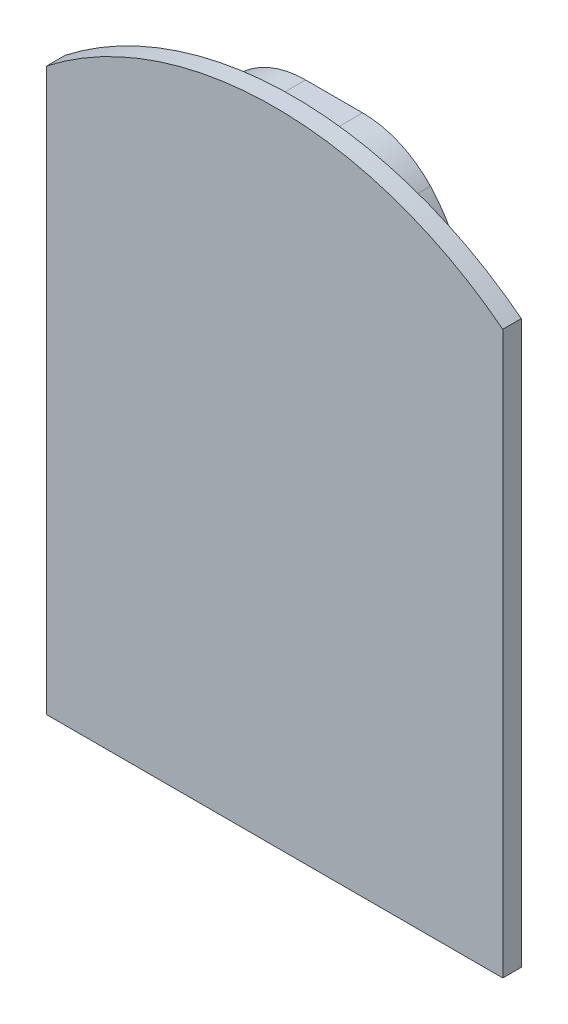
SolidWorks part; units mm, degrees
ref_plane "Front Plane" through (0, 0, 0) normal (0, 0, 1) x (1, 0, 0)
ref_plane "Top Plane" through (0, 0, 0) normal (0, 1, 0) x (1, 0, 0)
ref_plane "Right Plane" through (0, 0, 0) normal (1, 0, 0) x (0, 0, -1)
sketch "Sketch1" plane through (0, 0, 0) normal (0, 0, 1) x (1, 0, 0)
  line L0 (0, 0) -> (0, -30.3)
  line L1 (0, -30.3) -> (24.6, -30.3)
  line L2 (24.6, -30.3) -> (24.6, 0)
  arc A0 (0, 0) -> (24.6, 0) centre (12.3, -15.7705) cw
  dimension "D3" = 20
  dimension "D1" = 24.6
  dimension "D2" = 30.3
extrude "Boss-Extrude1" add sketch "Sketch1" along normal blind 1
sketch "Sketch2" plane through (0, 0, 0) normal (0, 0, -1) x (-1, 0, 0)
  line L0 (-12.3, 4.2295) -> (-12.3, -30.3) construction
  line L1 (0, -30.3) -> (-24.6, -30.3) construction
  line L2 (-15.312, 3.1295) -> (-9.288, 3.1295)
  arc A0 (0, 0) -> (-24.6, 0) centre (-12.3, -15.7705) ccw construction
  circle A1 centre (-12.3, -3.3) radius 6.1
  circle A2 centre (-12.3, -21.3) radius 6.1
  arc A3 (-15.312, 3.1295) -> (-9.288, 3.1295) centre (-12.3, -3.3) ccw
  circle A4 centre (-12.3, -21.3) radius 7.1
  dimension "D1" = 12.2
  dimension "D4" = 1
  dimension "D5" = 1
  dimension "D2" = 18
  dimension "D3" = 9
  dimension "D6" = 1.1
extrude "Boss-Extrude2" add sketch "Sketch2" along normal blind 2.2
fillet "Fillet1" radius 5 2 edges at (15.312, 3.1295, -1.1) (9.288, 3.1295, -1.1)
